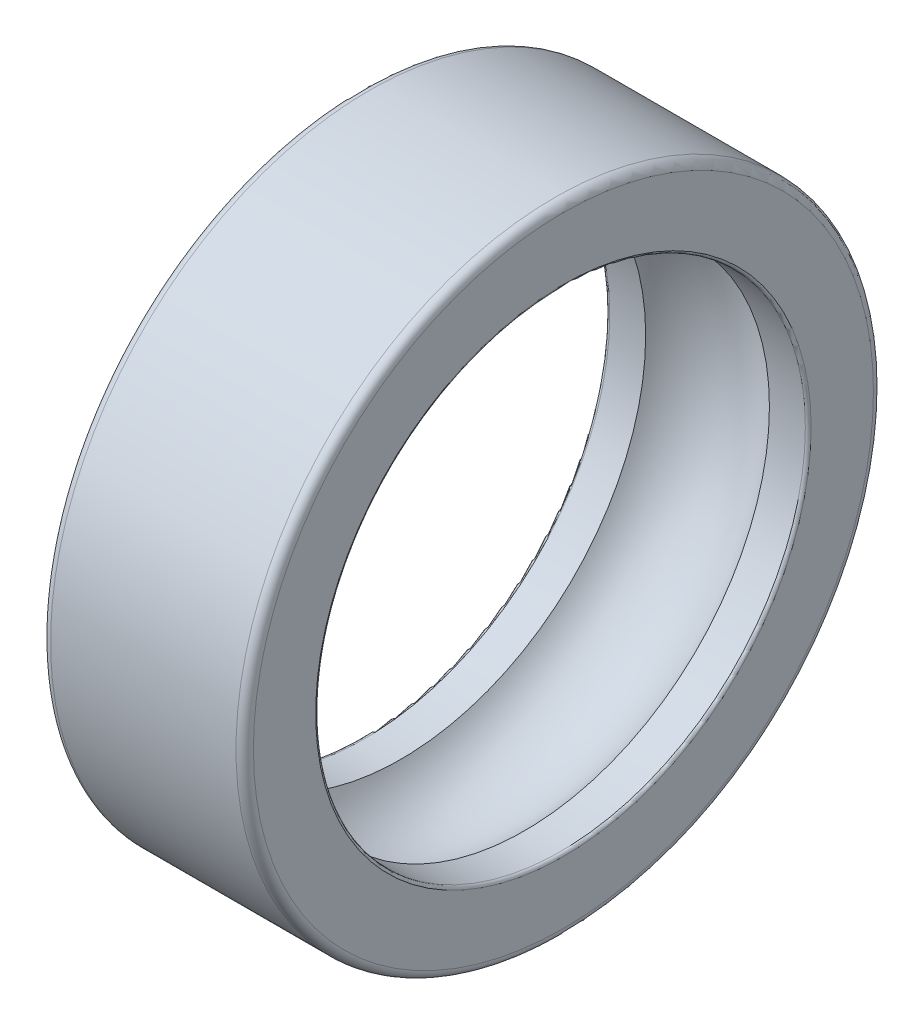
SolidWorks part; units mm, degrees
ref_plane "Front Plane" through (0, 0, 0) normal (0, 0, 1) x (1, 0, 0)
ref_plane "Top Plane" through (0, 0, 0) normal (0, 1, 0) x (1, 0, 0)
ref_plane "Right Plane" through (0, 0, 0) normal (1, 0, 0) x (0, 0, -1)
ref_plane "Plane4" through (0, 0, 0) normal (0, 0, 1) x (1, 0, 0)
sketch "Sketch1" plane through (0, 0, 0) normal (0, 0, 1) x (1, 0, 0)
  line L0 (-0.025, 10.7) -> (-0.025, 8.6)
  line L1 (0.125, 8.45) -> (1.3646, 8.45)
  line L2 (5.6354, 8.45) -> (6.875, 8.45)
  line L3 (6.975, 8.55) -> (6.975, 10.7)
  line L4 (6.675, 11) -> (0.275, 11)
  line L5 (9, 0) -> (0, 0) construction
  arc A0 (-0.025, 8.6) -> (0.125, 8.45) centre (0.125, 8.6) ccw
  arc A1 (1.3646, 8.45) -> (5.6354, 8.45) centre (3.5, 7.15) cw
  arc A2 (6.875, 8.45) -> (6.975, 8.55) centre (6.875, 8.55) ccw
  arc A3 (6.975, 10.7) -> (6.675, 11) centre (6.675, 10.7) ccw
  arc A4 (0.275, 11) -> (-0.025, 10.7) centre (0.275, 10.7) ccw
  dimension "D6" = 0.3
  dimension "D7" = 0.15
  dimension "D8" = 0.1
  dimension "D9" = 0.3
  dimension "D11" = 2.5
  dimension "D1" = 8.45
  dimension "D2" = 7.15
  dimension "D3" = 3.5
  dimension "D4" = 7
  dimension "D5" = 11
  dimension "D10" = 8.45
revolve "Revolve1" add sketch "Sketch1" angle 360 about L5
